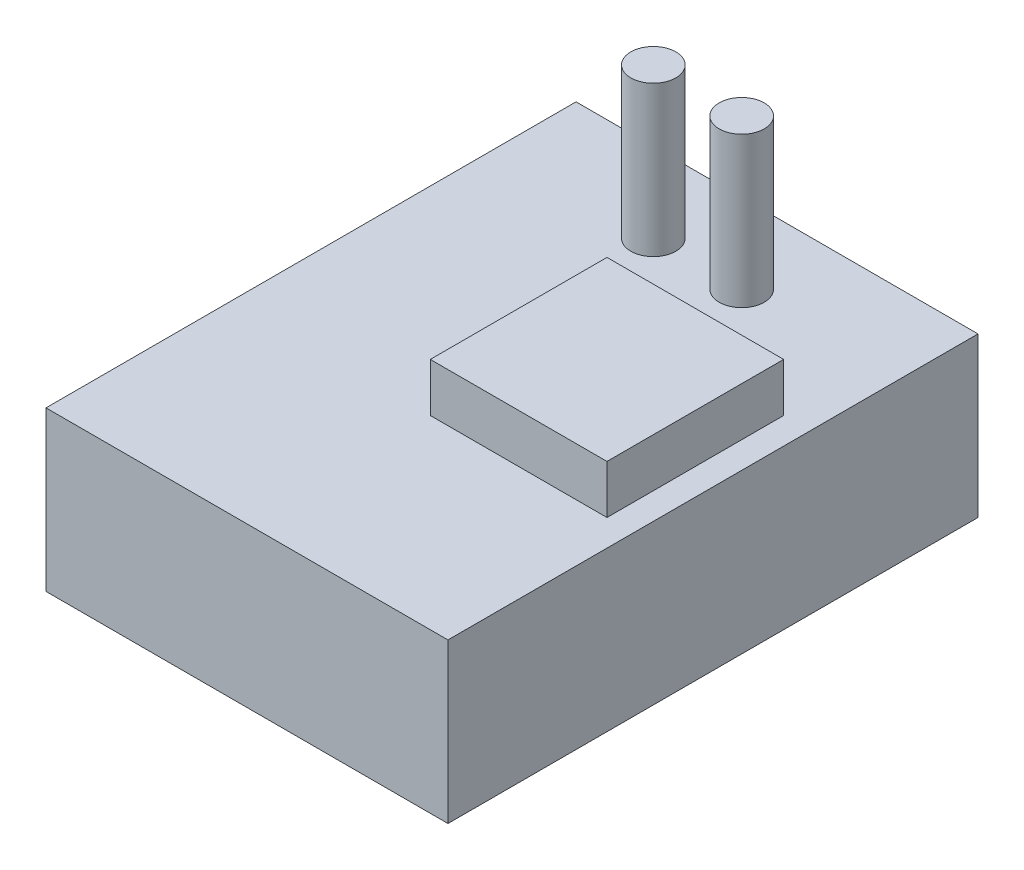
SolidWorks part; units mm, degrees
ref_plane "Plano frontal" through (0, 0, 0) normal (0, 0, 1) x (1, 0, 0)
ref_plane "Plano superior" through (0, 0, 0) normal (0, 1, 0) x (1, 0, 0)
ref_plane "Plano direito" through (0, 0, 0) normal (1, 0, 0) x (0, 0, -1)
sketch "Esboço1" plane through (0, 0, 0) normal (0, 1, 0) x (1, 0, 0)
  line L1 (-45.5, 60) -> (45.5, 60)
  line L2 (-45.5, 60) -> (-45.5, -60)
  line L3 (-45.5, -60) -> (45.5, -60)
  line L4 (45.5, 60) -> (45.5, -60)
  line L5 (-45.5, 60) -> (45.5, -60) construction
  line L6 (-45.5, -60) -> (45.5, 60) construction
  point P0 (0, 0)
  dimension "D1" = 120
  dimension "D2" = 91
extrude "Ressalto-extrusão1" add sketch "Esboço1" along normal blind 36
sketch "Esboço2" plane through (0, 36, 0) normal (0, 1, 0) x (1, 0, 0)
  line L0 (-45.5, -60) -> (45.5, -60) construction
  line L1 (-0.5, 22) -> (39.5, 22)
  line L2 (-0.5, 22) -> (-0.5, -18)
  line L3 (-0.5, -18) -> (39.5, -18)
  line L4 (39.5, 22) -> (39.5, -18)
  line L5 (-0.5, 22) -> (39.5, -18) construction
  line L6 (-0.5, -18) -> (39.5, 22) construction
  line L7 (-45.5, 60) -> (-45.5, -60) construction
  point P0 (19.5, 2)
  dimension "D1" = 82
  dimension "D2" = 40
  dimension "D3" = 85
extrude "Ressalto-extrusão2" add sketch "Esboço2" along normal blind 11
sketch "Esboço3" plane through (0, 36, 0) normal (0, 1, 0) x (1, 0, 0)
  line L0 (0, 60) -> (0, -60) construction
  line L1 (45.5, 60) -> (-45.5, 60) construction
  line L2 (-45.5, -60) -> (45.5, -60) construction
  line L3 (-10, 42) -> (10, 42) construction
  circle A0 centre (-10, 42) radius 5.1
  circle A1 centre (10, 42) radius 5.1
  point P10 (0, 42)
  dimension "D1" = 10.2
  dimension "D3" = 18
  dimension "D2" = 20
extrude "Ressalto-extrusão3" add sketch "Esboço3" along normal blind 34
